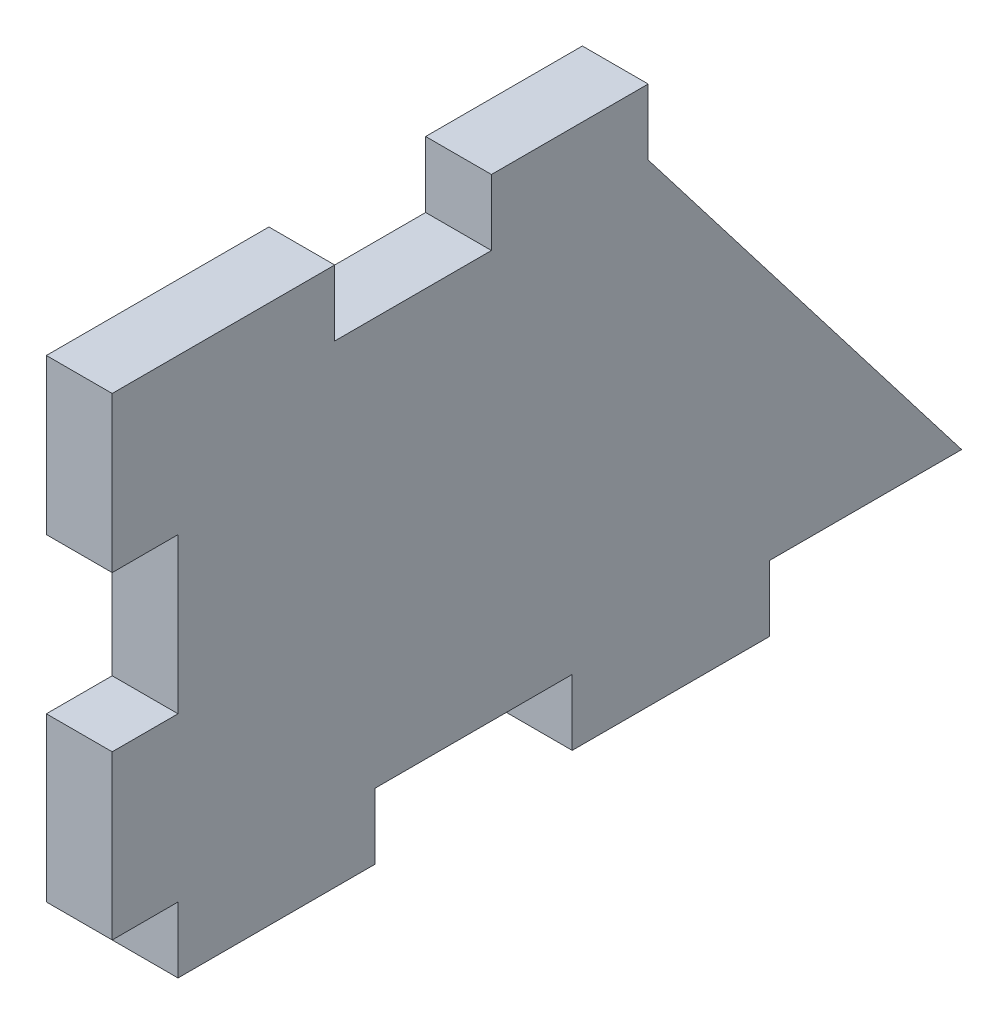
SolidWorks part; units mm, degrees
ref_plane "Front Plane" through (0, 0, 0) normal (0, 0, 1) x (1, 0, 0)
ref_plane "Top Plane" through (0, 0, 0) normal (0, 1, 0) x (1, 0, 0)
ref_plane "Right Plane" through (0, 0, 0) normal (1, 0, 0) x (0, 0, -1)
sketch "Sketch1" plane through (0, 0, 0) normal (1, 0, 0) x (0, 0, -1)
  line L1 (-31.75, -16.51) -> (31.75, -16.51)
  line L2 (-31.75, -16.51) -> (-31.75, 16.51)
  line L3 (-31.75, 16.51) -> (31.75, 16.51)
  line L4 (31.75, -16.51) -> (31.75, 16.51)
  line L5 (-31.75, -16.51) -> (31.75, 16.51) construction
  line L6 (-31.75, 16.51) -> (31.75, -16.51) construction
  point P0 (0, 0)
  dimension "D1" = 33.02
  dimension "D2" = 63.5
extrude "Boss-Extrude1" add sketch "Sketch1" along normal blind 5.334
sketch "Sketch2" plane through (0, 0, 0) normal (-1, 0, 0) x (0, 0, 1)
  line L1 (-31.75, -16.51) -> (-31.75, 16.51)
  line L5 (-31.75, 16.51) -> (31.75, 16.51) construction
  line L18 (-31.75, -16.51) -> (-6.35, 16.51)
  line L19 (-6.35, 16.51) -> (-31.75, 16.51)
extrude "Cut-Extrude1" cut sketch "Sketch2" against normal through all
sketch "Sketch3" plane through (0, 0, 0) normal (-1, 0, 0) x (0, 0, 1)
  line L0 (31.75, -16.51) -> (-31.75, -16.51) construction
  line L1 (31.75, 16.51) -> (19.05, 16.51)
  line L2 (31.75, 16.51) -> (31.75, 21.844)
  line L3 (31.75, 21.844) -> (19.05, 21.844)
  line L4 (19.05, 16.51) -> (19.05, 21.844)
  line L5 (-6.35, 16.51) -> (6.35, 16.51)
  line L6 (-6.35, 16.51) -> (-6.35, 21.844)
  line L7 (-6.35, 21.844) -> (6.35, 21.844)
  line L8 (6.35, 16.51) -> (6.35, 21.844)
  line L9 (31.75, -16.51) -> (15.7787, -16.51)
  line L10 (31.75, -16.51) -> (31.75, -21.844)
  line L11 (31.75, -21.844) -> (15.7787, -21.844)
  line L12 (15.7787, -16.51) -> (15.7787, -21.844)
  line L13 (-0.1926, -16.51) -> (-16.164, -16.51)
  line L14 (-0.1926, -16.51) -> (-0.1926, -21.844)
  line L15 (-0.1926, -21.844) -> (-16.164, -21.844)
  line L16 (-16.164, -16.51) -> (-16.164, -21.844)
  line L17 (6.35, 21.844) -> (19.05, 21.844) construction
  line L18 (15.7787, -21.844) -> (-0.1926, -21.844) construction
  line L19 (-16.164, -21.844) -> (-32.1353, -21.844) construction
  dimension "D1" = 5.334
  dimension "D2" = 5.334
extrude "Boss-Extrude2" add sketch "Sketch3" against normal through all
sketch "Sketch4" plane through (0, 0, 0) normal (-1, 0, 0) x (0, 0, 1)
  line L2 (31.75, 21.844) -> (31.75, -21.844) construction
  line L3 (31.75, -15.875) -> (37.084, -15.875)
  line L4 (31.75, -15.875) -> (31.75, 21.209)
  line L5 (31.75, 21.209) -> (37.084, 21.209)
  line L6 (37.084, -15.875) -> (37.084, 21.209)
  dimension "D1" = 5.334
extrude "Boss-Extrude7" add sketch "Sketch4" against normal blind 5.334
sketch "Sketch5" plane through (5.334, 0, 0) normal (1, 0, 0) x (0, 0, -1)
  line L1 (-37.084, -15.875) -> (-37.084, 21.209) construction
  line L2 (-37.084, -3.302) -> (-31.75, -3.302)
  line L3 (-37.084, -3.302) -> (-37.084, 9.271)
  line L4 (-37.084, 9.271) -> (-31.75, 9.271)
  line L5 (-31.75, -3.302) -> (-31.75, 9.271)
  line L6 (-31.75, 9.271) -> (-31.75, 21.844) construction
  line L7 (-31.75, 21.844) -> (-19.05, 21.844) construction
  line L8 (-31.75, -3.302) -> (-31.75, -15.875) construction
extrude "Cut-Extrude2" cut sketch "Sketch5" against normal through all
sketch "Sketch6" plane through (5.334, 0, 0) normal (1, 0, 0) x (0, 0, -1)
  line L1 (-37.084, 21.209) -> (-31.75, 21.209)
  line L2 (-37.084, 21.209) -> (-37.084, 21.844)
  line L3 (-37.084, 21.844) -> (-31.75, 21.844)
  line L4 (-31.75, 21.209) -> (-31.75, 21.844)
extrude "Boss-Extrude9" add sketch "Sketch6" against normal blind 5.334
sketch "Sketch7" plane through (5.334, 0, 0) normal (1, 0, 0) x (0, 0, -1)
  line L0 (-31.75, -15.875) -> (-31.75, -21.844) construction
  line L1 (-31.75, -16.51) -> (-37.084, -16.51)
  line L2 (-31.75, -16.51) -> (-31.75, -15.875)
  line L3 (-31.75, -15.875) -> (-37.084, -15.875)
  line L4 (-37.084, -16.51) -> (-37.084, -15.875)
extrude "Boss-Extrude10" add sketch "Sketch7" against normal blind 5.334
equation "\"D1@Boss-Extrude1\" = \"material\""
equation "\"D1@Boss-Extrude7\"=\"material\""
equation "\"material\"=\"MDF@Platform.assembly\""
equation "\"D1@Boss-Extrude9\" = \"material\""
equation "\"D1@Boss-Extrude10\" = \"material\""
